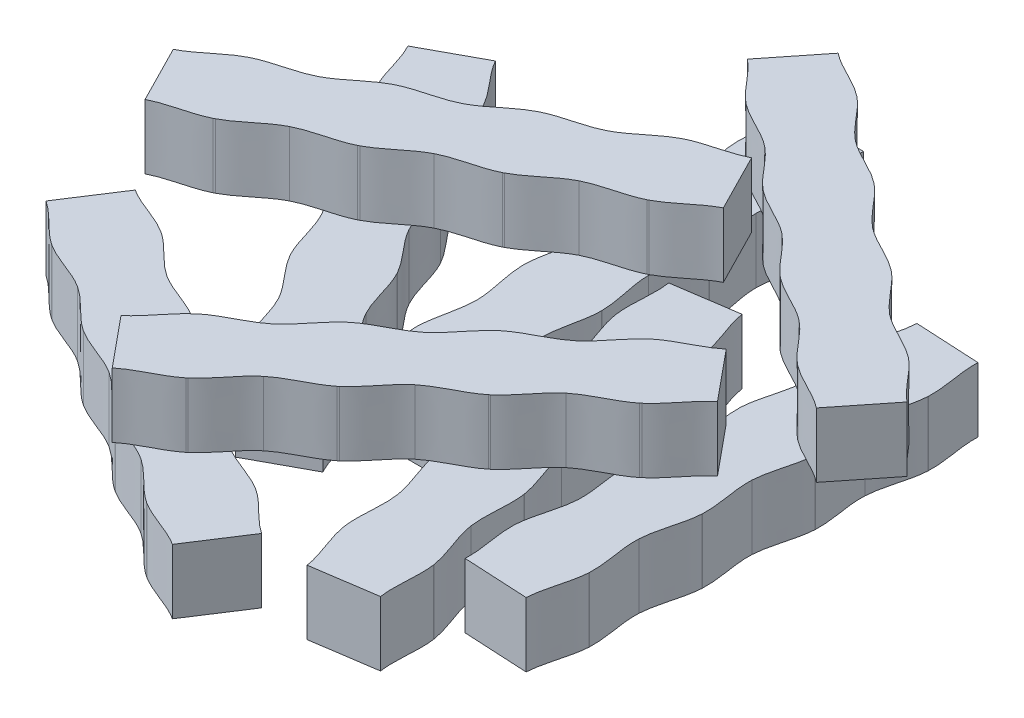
SolidWorks part; units mm, degrees
ref_plane "Front Plane" through (0, 0, 0) normal (0, 0, 1) x (1, 0, 0)
ref_plane "Top Plane" through (0, 0, 0) normal (0, 1, 0) x (1, 0, 0)
ref_plane "Right Plane" through (0, 0, 0) normal (1, 0, 0) x (0, 0, -1)
sketch "Sketch1" plane through (0, 0, 0) normal (0, 1, 0) x (1, 0, 0)
  line L0 (-4.5005, 60.0001) -> (4.5004, 60.0001)
  line L1 (5.5003, 52.5335) -> (5.5003, 52.4665)
  line L2 (5.5003, 37.5335) -> (5.5003, 37.4665)
  line L3 (5.5003, 22.5335) -> (5.5003, 22.4665)
  line L4 (5.5003, 7.5335) -> (5.5003, 7.4665)
  line L5 (4.5004, 0) -> (-4.5005, 0)
  line L6 (-5.4998, 7.3828) -> (-5.4998, 7.6172)
  line L7 (-5.4998, 22.3828) -> (-5.4998, 22.6172)
  line L8 (-5.4998, 37.3828) -> (-5.4998, 37.6172)
  line L9 (-5.4998, 52.3828) -> (-5.4998, 52.6172)
  spline S0 degree 3 poles (4.5004, 60.0001) (4.5004, 57.5113) (5.4915, 55.0223) (5.5003, 52.5335) knots 0.038462 0.038462 0.038462 0.038462 0.076923 0.076923 0.076923 0.076923
  spline S1 degree 3 poles (5.5003, 52.4665) (5.4915, 49.9777) (4.5004, 47.4888) (4.5004, 45) knots 0.115385 0.115385 0.115385 0.115385 0.153846 0.153846 0.153846 0.153846
  spline S2 degree 3 poles (4.5004, 45) (4.5004, 42.5112) (5.4915, 40.0223) (5.5003, 37.5335) knots 0.153846 0.153846 0.153846 0.153846 0.192308 0.192308 0.192308 0.192308
  spline S3 degree 3 poles (5.5003, 37.4665) (5.4915, 34.9777) (4.5004, 32.4888) (4.5004, 30) knots 0.230769 0.230769 0.230769 0.230769 0.269231 0.269231 0.269231 0.269231
  spline S4 degree 3 poles (4.5004, 30) (4.5004, 27.5112) (5.4915, 25.0223) (5.5003, 22.5335) knots 0.269231 0.269231 0.269231 0.269231 0.307692 0.307692 0.307692 0.307692
  spline S5 degree 3 poles (5.5003, 22.4665) (5.4915, 19.9777) (4.5004, 17.4888) (4.5004, 15) knots 0.346154 0.346154 0.346154 0.346154 0.384615 0.384615 0.384615 0.384615
  spline S6 degree 3 poles (4.5004, 15) (4.5004, 12.5112) (5.4915, 10.0223) (5.5003, 7.5335) knots 0.384615 0.384615 0.384615 0.384615 0.423077 0.423077 0.423077 0.423077
  spline S7 degree 3 poles (5.5003, 7.4665) (5.4915, 4.9777) (4.5004, 2.4888) (4.5004, 0) knots 0.461538 0.461538 0.461538 0.461538 0.5 0.5 0.5 0.5
  spline S8 degree 3 poles (-4.5005, 0) (-4.5005, 2.4609) (-5.4695, 4.9219) (-5.4998, 7.3828) knots 0.538462 0.538462 0.538462 0.538462 0.576923 0.576923 0.576923 0.576923
  spline S9 degree 3 poles (-5.4998, 7.6172) (-5.4695, 10.0781) (-4.5005, 12.5391) (-4.5005, 15) knots 0.615385 0.615385 0.615385 0.615385 0.653846 0.653846 0.653846 0.653846
  spline S10 degree 3 poles (-4.5005, 15) (-4.5005, 17.4609) (-5.4695, 19.9219) (-5.4998, 22.3828) knots 0.653846 0.653846 0.653846 0.653846 0.692308 0.692308 0.692308 0.692308
  spline S11 degree 3 poles (-5.4998, 22.6172) (-5.4695, 25.0781) (-4.5005, 27.5391) (-4.5005, 30) knots 0.730769 0.730769 0.730769 0.730769 0.769231 0.769231 0.769231 0.769231
  spline S12 degree 3 poles (-4.5005, 30) (-4.5005, 32.4609) (-5.4695, 34.9219) (-5.4998, 37.3828) knots 0.769231 0.769231 0.769231 0.769231 0.807692 0.807692 0.807692 0.807692
  spline S13 degree 3 poles (-5.4998, 37.6172) (-5.4695, 40.0781) (-4.5005, 42.5391) (-4.5005, 45) knots 0.846154 0.846154 0.846154 0.846154 0.884615 0.884615 0.884615 0.884615
  spline S14 degree 3 poles (-4.5005, 45) (-4.5005, 47.4609) (-5.4695, 49.9219) (-5.4998, 52.3828) knots 0.884615 0.884615 0.884615 0.884615 0.923077 0.923077 0.923077 0.923077
  spline S15 degree 3 poles (-5.4998, 52.6172) (-5.4695, 55.0781) (-4.5005, 57.5392) (-4.5005, 60.0001) knots 0.961538 0.961538 0.961538 0.961538 1 1 1 1
extrude "Boss-Extrude1" add sketch "Sketch1" along normal blind 9
sketch "Sketch2" plane through (0, 0, 0) normal (0, 1, 0) x (1, 0, 0)
  circle A1 centre (-0.1622, -0.0668) radius 50 construction
move or copy body "Body-Move/Copy1" bodies to move or copy 101 copy no translate (0, 0, 5.5598)
move or copy body "Body-Move/Copy2" bodies to move or copy 102 copy yes number of copies 1 translate (-26, 0, 39.5604)
move or copy body "Body-Move/Copy3" bodies to move or copy 103 copy yes number of copies 1 translate (41.7172, 0, 0)
move or copy body "Body-Move/Copy4" bodies to move or copy 104 copy yes number of copies 1 translate (23.9501, 0, -37.8497)
move or copy body "Body-Move/Copy5" bodies to move or copy 102 copy yes number of copies 1 translate (-47.1517, 0, 0)
move or copy body "Body-Move/Copy6" bodies to move or copy 103 copy no rotation origin (-25.9997, 0, 15.1202) rotation axis (0, 1, 0) rotation angle 57
move or copy body "Body-Move/Copy7" bodies to move or copy 107 copy no translate (7.0755, 0, 20.7425)
move or copy body "Body-Move/Copy8" bodies to move or copy 106 copy no rotation origin (-47.1515, 0, -24.4402) rotation axis (0, 1, 0) rotation angle 47
move or copy body "Body-Move/Copy9" bodies to move or copy 109 copy no translate (17.9633, 0, 21.1702)
move or copy body "Body-Move/Copy10" bodies to move or copy 105 copy no rotation origin (39.6676, 0, -22.7295) rotation axis (0, -1, 0) rotation angle 18
move or copy body "Body-Move/Copy11" bodies to move or copy 111 copy no translate (0, 0, 26.3023)
move or copy body "Body-Move/Copy12" bodies to move or copy 102 110 104 copy yes number of copies 1 translate (0, 9, 0)
move or copy body "Body-Move/Copy13" bodies to move or copy 114 113 115 copy no rotation origin (-4.4902, 0, -4.1966) rotation axis (0, 1, 0) rotation angle 117
move or copy body "Body-Move/Copy14" bodies to move or copy 116 copy no rotation origin (7.5483, 0, 17.3888) rotation axis (0, -1, 0) rotation angle 34.5
move or copy body "Body-Move/Copy15" bodies to move or copy 118 copy no rotation origin (3.5472, 0, -30.9712) rotation axis (0, -1, 0) rotation angle 53.5
move or copy body "Body-Move/Copy16" bodies to move or copy 120 copy no translate (17, 0, 0)
move or copy body "Body-Move/Copy17" bodies to move or copy 117 copy no translate (0, 0, -15.7893)
move or copy body "Body-Move/Copy18" bodies to move or copy 102 copy no translate (0, 0, 6.8004)
move or copy body "Body-Move/Copy19" bodies to move or copy 110 copy no rotation origin (-29.1883, 0, -3.2699) rotation axis (0, -1, 0) rotation angle 18.5
move or copy body "Body-Move/Copy20" bodies to move or copy 124 copy no translate (7.4543, 0, -1.107)
move or copy body "Body-Move/Copy21" bodies to move or copy 122 copy no translate (6.3579, 0, 2.3722)
move or copy body "Body-Move/Copy22" bodies to move or copy 112 copy no translate (-3.7701, 0, 0)
move or copy body "Body-Move/Copy23" bodies to move or copy 127 copy no rotation origin (35.8973, 0, 3.5728) rotation axis (0, 1, 0) rotation angle 15
move or copy body "Body-Move/Copy24" bodies to move or copy 128 copy no translate (-3.9336, 0, -3.9537)
move or copy body "Body-Move/Copy25" bodies to move or copy 104 copy no rotation origin (15.7175, 0, 15.1202) rotation axis (0, 1, 0) rotation angle 8.5
move or copy body "Body-Move/Copy26" bodies to move or copy 130 copy no translate (0, 0, -4.27)
move or copy body "Body-Move/Copy27" bodies to move or copy 108 copy no translate (0, 0, -7.9074)
move or copy body "Body-Move/Copy28" bodies to move or copy 121 copy no rotation origin (20.5472, 0, -30.9712) rotation axis (0, -1, 0) rotation angle 12
move or copy body "Body-Move/Copy29" bodies to move or copy 133 copy no translate (0, 0, 4.4282)
